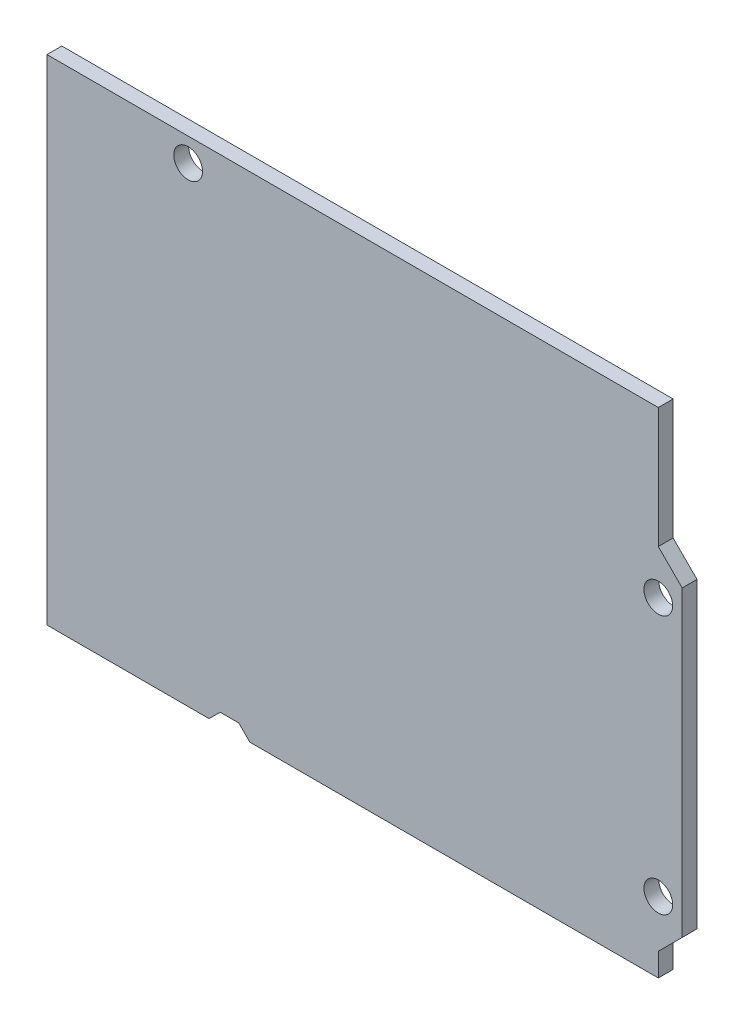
SolidWorks part; units mm, degrees
ref_plane "Plan de face" through (0, 0, 0) normal (0, 0, 1) x (1, 0, 0)
ref_plane "Plan de dessus" through (0, 0, 0) normal (0, 1, 0) x (1, 0, 0)
ref_plane "Plan de droite" through (0, 0, 0) normal (1, 0, 0) x (0, 0, -1)
sketch "Esquisse1" plane through (0, 0, 0) normal (0, 0, 1) x (1, 0, 0)
  line L0 (0, 0) -> (0, 53.34)
  line L1 (0, 53.34) -> (66, 53.34)
  line L2 (66, 53.34) -> (66, 40.34)
  line L3 (66, 40.34) -> (68.58, 37.76)
  line L4 (68.58, 37.76) -> (68.58, 5.08)
  line L5 (68.58, 5.08) -> (66, 2.5)
  line L6 (66, 2.5) -> (66, 0)
  line L7 (66, 0) -> (21.9, 0)
  line L8 (21.9, 0) -> (20.7, 1.2)
  line L9 (20.7, 1.2) -> (18.7, 1.2)
  line L10 (18.7, 1.2) -> (17.5, 0)
  line L11 (17.5, 0) -> (0, 0)
  circle A0 centre (15.24, 50.8) radius 1.55
  circle A1 centre (66, 35.56) radius 1.55
  circle A2 centre (66, 7.62) radius 1.55
  dimension "D1" = 3.1
  dimension "D4" = 15.24
  dimension "D6" = 35.56
  dimension "D7" = 7.62
  dimension "D2" = 53.34
  dimension "D3" = 50.8
  dimension "D5" = 13
  dimension "D8" = 2.5
  dimension "D9" = 68.58
  dimension "D10" = 66
  dimension "D11" = 2
  dimension "D12" = 1.2
  dimension "D13" = 18.7
extrude "Boss.-Extru.1" add sketch "Esquisse1" along normal blind 1.6
